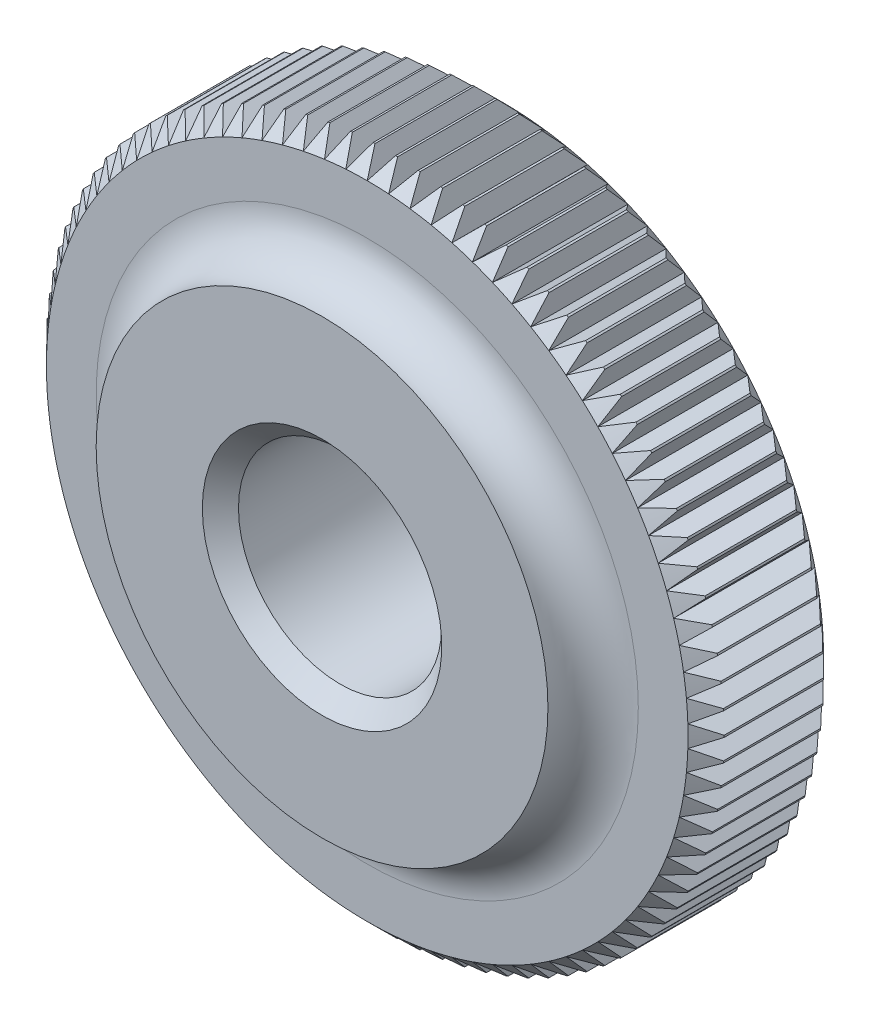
SolidWorks part; units mm, degrees
ref_plane "前视" through (0, 0, 0) normal (0, 0, 1) x (1, 0, 0)
ref_plane "上视" through (0, 0, 0) normal (0, 1, 0) x (1, 0, 0)
ref_plane "右视" through (0, 0, 0) normal (1, 0, 0) x (0, 0, -1)
sketch "Sketch1" plane through (0, 0, 0) normal (0, 0, 1) x (1, 0, 0)
  circle A0 centre (0, 0) radius 15
  dimension "dk" = 30
extrude "BaseNut" add sketch "Sketch1" against normal blind 6
sketch "Sketch2" plane through (2.2068, 1.9379, -6) normal (0, 0, -1) x (-1, 0, 0)
  circle A0 centre (2.2068, -1.9379) radius 10
  circle A1 centre (2.2068, -1.9379) radius 15 construction
  dimension "dw" = 20
extrude "Extrude1" add sketch "Sketch2" against normal blind 8
fillet "Fillet1" radius 2 1 edges at (10, 0, 0)
sketch "Sketch3" plane through (-1.1811, -0.1207, 2) normal (0, 0, 1) x (1, 0, 0)
  circle A0 centre (1.1811, 0.1207) radius 4.5
  circle A1 centre (1.1811, 0.1207) radius 10 construction
  dimension "D1" = 9
extrude "Hole1" cut sketch "Sketch3" against normal through all
sketch "Sketch4" plane through (0, 0, 0) normal (0, 1, 0) x (1, 0, 0)
  line L0 (0, 2.6341) -> (0, -9.703) construction
  line L2 (4.5, 6) -> (5.4, 6)
  line L5 (5.4, 6) -> (4.5, 5.1)
  line L7 (4.5, 5.1) -> (4.5, 6)
  dimension "Da" = 10.8
  dimension "D2" = 45
revolve "EndChamfer" [suppressed] cut sketch "Sketch4" angle 360 about L0
chamfer "Chamfer1" distance 0.8 angle 45 2 edges at (15, 0, -6) (15, 0, 0)
sketch "Sketch5" plane through (0, 6, -6) normal (0, 0, -1) x (1, 0, 0)
  line L0 (-0.25, 20.9979) -> (-0.25, 20.1978) construction
  line L1 (0, 22.5643) -> (0, 11.3282) construction
  line L2 (0.25, 20.9979) -> (0.25, 20.1978) construction
  line L4 (-0.6928, 21.4) -> (0, 20.2)
  line L5 (0, 20.2) -> (0.6928, 21.4)
  line L6 (0.6928, 21.4) -> (-0.6928, 21.4)
  circle A0 centre (0, 6) radius 14.2 construction
  arc A1 (0.25, 20.1978) -> (-0.25, 20.1978) centre (0, 6) ccw construction
  arc A2 (0.25, 20.9979) -> (-0.25, 20.9979) centre (0, 6) ccw construction
  circle A4 centre (0, 21) radius 0.4 construction
  circle A5 centre (0, 6) radius 15 construction
  dimension "D2" = 0.5
extrude "Cut-Extrude1" cut sketch "Sketch5" against normal through all
pattern_circular "CirPattern1" count 94 over 360 about axis through (0, 0, 0) along (0, 0, 1) of "Cut-Extrude1"
chamfer "Chamfer2" distance 0.8 angle 45 1 edges at (4.5, 0, 2)
sketch "Sketch7" plane through (0, 0, 0) normal (1, 0, 0) x (0, 0, -1)
  line L0 (13.2499, 0) -> (-8.3535, 0) construction
  line L1 (-0.95, -4) -> (-1.45, -4)
  line L2 (-1.45, -4) -> (-1.45, -4.5)
  line L3 (-1.45, -4.5) -> (-1.2, -4.933)
  line L4 (-1.2, -4.933) -> (-0.95, -4.5)
  line L5 (-0.95, -4.5) -> (-0.95, -4)
  line L6 (-1.2, -4.5) -> (-1.2, 4.5) construction
  dimension "D1" = 0.5
  dimension "D2" = 9
revolve "Cut-Revolve10" [suppressed] cut sketch "Sketch7" angle 360 about L0
pattern_linear "LPattern10" [suppressed] count 12 spacing 0.6 along (0, 0, 1)
equation "\"D2@Sketch5\" = \"dk@Sketch1\" / 30"
equation "\"D1@CirPattern1\" = int ( 3.14 / atn ( 2 * \"D2@Sketch5\" / \"dk@Sketch1\" )  ) "
equation "\"D1@Chamfer2\" = \"D1@Chamfer1\""
equation "\"D2@Sketch7\" = \"D1@Sketch3\""
equation "\"D1@Sketch7\" =  ( \"D2@ThreadCosmetic1\" - \"D1@Sketch3\" )  / 2"
equation "\"D3@LPattern10\" = \"D1@Sketch7\" * 1.2 "
equation "\"D1@LPattern10\" =\"m@Extrude1\" / \"D3@LPattern10\" - 1"
